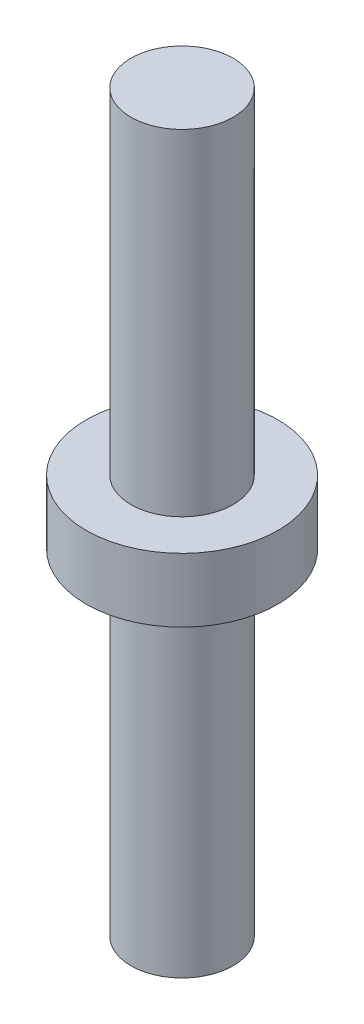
SolidWorks part; units mm, degrees
ref_plane "前视基准面" through (0, 0, 0) normal (0, 0, 1) x (1, 0, 0)
ref_plane "上视基准面" through (0, 0, 0) normal (0, 1, 0) x (1, 0, 0)
ref_plane "右视基准面" through (0, 0, 0) normal (1, 0, 0) x (0, 0, -1)
other "Configuration Table"
sketch "草图1" plane through (0, 0, 0) normal (0, 1, 0) x (1, 0, 0)
  circle A0 centre (0, 0) radius 3
extrude "凸台-拉伸1" add sketch "草图1" along normal blind 2
sketch "草图2" plane through (0, 2, 0) normal (0, 1, 0) x (1, 0, 0)
  circle A0 centre (0, 0) radius 1.6
extrude "凸台-拉伸2" add sketch "草图2" along normal blind 10.5
sketch "草图3" plane through (0, 0, 0) normal (0, -1, 0) x (1, 0, 0)
  circle A0 centre (0, 0) radius 1.6
extrude "凸台-拉伸3" add sketch "草图3" along normal blind 10.5
